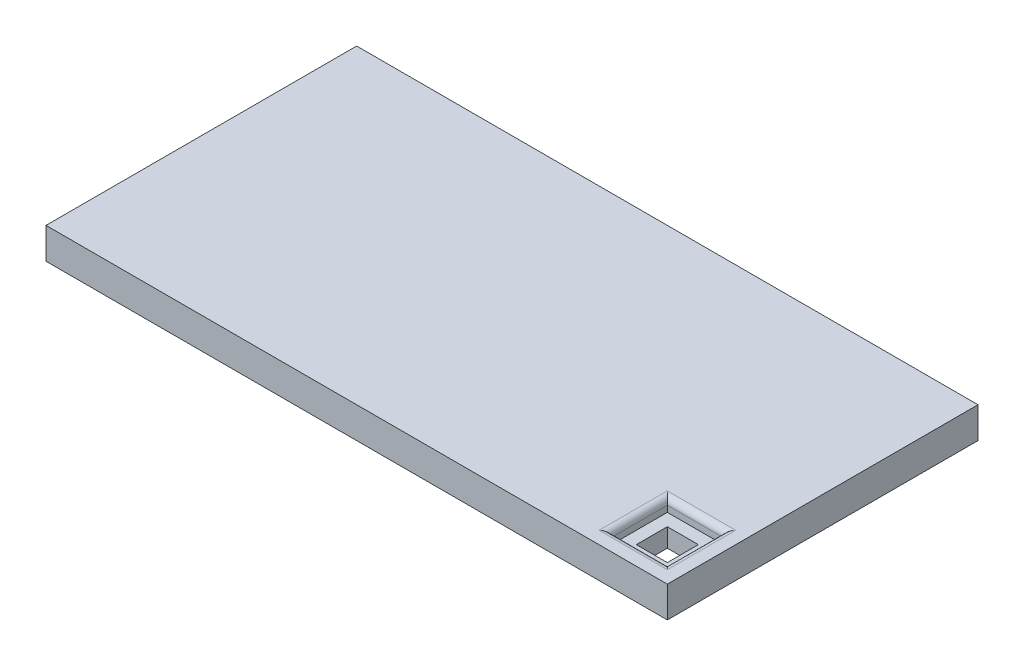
SolidWorks part; units mm, degrees
ref_plane "Front Plane" through (0, 0, 0) normal (0, 0, 1) x (1, 0, 0)
ref_plane "Top Plane" through (0, 0, 0) normal (0, 1, 0) x (1, 0, 0)
ref_plane "Right Plane" through (0, 0, 0) normal (1, 0, 0) x (0, 0, -1)
sketch "Sketch1" plane through (0, 0, 0) normal (0, 1, 0) x (1, 0, 0)
  line L1 (0, 0) -> (-100, 0)
  line L2 (0, 0) -> (0, 50)
  line L3 (0, 50) -> (-100, 50)
  line L4 (-100, 0) -> (-100, 50)
  dimension "D1" = 50
  dimension "D2" = 100
extrude "Extrude1" add sketch "Sketch1" along normal blind 5
sketch "Sketch2" plane through (0, 5, 0) normal (0, 1, 0) x (-1, 0, 0)
  line L0 (100, 0) -> (0, 0) construction
  line L1 (5, -5) -> (10, -5)
  line L2 (5, -5) -> (5, -10)
  line L3 (5, -10) -> (10, -10)
  line L4 (10, -5) -> (10, -10)
  line L5 (0, 0) -> (0, -50) construction
  dimension "D1" = 5
  dimension "D2" = 5
  dimension "D3" = 5
  dimension "D4" = 5
extrude "Cut-Extrude1" cut sketch "Sketch2" against normal blind 5
sketch "Sketch3" plane through (0, 5, 0) normal (0, 1, 0) x (-1, 0, 0)
  line L9 (3, -3) -> (3, -12)
  line L10 (12, -3) -> (3, -3)
  line L11 (12, -12) -> (12, -3)
  line L12 (3, -12) -> (12, -12)
  line L13 (3, -3) -> (3, -12)
  line L14 (12, -3) -> (3, -3)
  line L15 (12, -12) -> (12, -3)
  line L16 (3, -12) -> (12, -12)
  dimension "D1" = 2
extrude "Cut-Extrude2" cut sketch "Sketch3" against normal blind 2
fillet "Fillet2" radius 1 4 edges at (-7.5, 5, -3) (-3, 5, -7.5) (-7.5, 5, -12) (-12, 5, -7.5)
